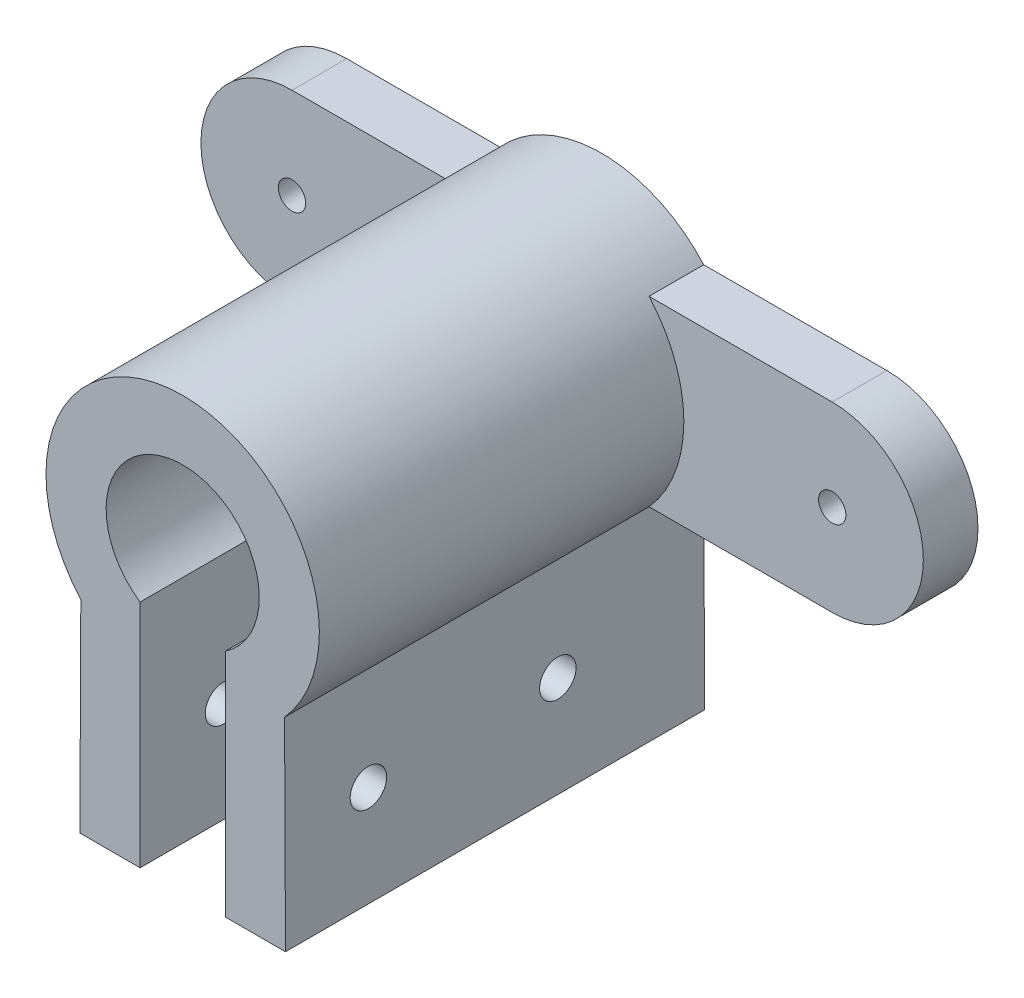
SolidWorks part; units mm, degrees
ref_plane "Front Plane" through (0, 0, 0) normal (0, 0, 1) x (1, 0, 0)
ref_plane "Top Plane" through (0, 0, 0) normal (0, 1, 0) x (1, 0, 0)
ref_plane "Right Plane" through (0, 0, 0) normal (1, 0, 0) x (0, 0, -1)
sketch "Sketch1" plane through (0, 0, 0) normal (0, 0, 1) x (1, 0, 0)
  line L0 (-7.1304, -254.7822) -> (-36.7704, -254.7822) construction
  line L1 (-7.1304, -259.7822) -> (-17.1803, -259.7822)
  line L2 (-7.1304, -249.7822) -> (-17.1803, -249.7822)
  line L3 (-28.3606, -259.7822) -> (-36.7704, -259.7822)
  line L4 (-28.3606, -249.7822) -> (-36.7704, -249.7822)
  circle A0 centre (-7.1304, -254.7822) radius 0.75
  circle A1 centre (-36.7704, -254.7822) radius 0.75
  arc A2 (-7.1304, -259.7822) -> (-7.1304, -249.7822) centre (-7.1304, -254.7822) ccw
  arc A3 (-36.7704, -249.7822) -> (-36.7704, -259.7822) centre (-36.7704, -254.7822) ccw
  circle A4 centre (-22.7704, -254.7822) radius 4 construction
  arc A5 (-28.3606, -259.7822) -> (-17.1803, -259.7822) centre (-22.7704, -254.7822) ccw
  arc A6 (-17.1803, -249.7822) -> (-28.3606, -249.7822) centre (-22.7704, -254.7822) ccw
  point P4 (-21.9504, -254.7822)
  dimension "D1" = 10
  dimension "D2" = 29.64
extrude "Boss-Extrude1" add sketch "Sketch1" along normal blind 3
sketch "Sketch2" plane through (0, 0, 3) normal (0, 0, 1) x (1, 0, 0)
  line L0 (-25.1066, -261.909) -> (-25.1066, -258.2725)
  line L1 (-22.7704, -254.7822) -> (-22.7704, -262.2822) construction
  line L2 (-20.4342, -261.909) -> (-20.4342, -258.2725)
  line L3 (-25.1066, -261.909) -> (-25.1066, -270.9041)
  line L4 (-25.1066, -270.9041) -> (-28.4117, -270.9041)
  line L5 (-28.4117, -270.9041) -> (-28.3606, -259.7822)
  line L6 (-36.7704, -259.7822) -> (-28.3606, -259.7822) construction
  line L7 (-20.4342, -261.909) -> (-20.4342, -270.9041)
  line L8 (-20.4342, -270.9041) -> (-17.1292, -270.9041)
  line L9 (-17.1292, -270.9041) -> (-17.1803, -259.7822)
  arc A0 (-20.4342, -258.2725) -> (-25.1066, -258.2725) centre (-22.7704, -254.7822) ccw
  arc A1 (-17.1803, -259.7822) -> (-28.3606, -259.7822) centre (-22.7704, -254.7822) ccw
extrude "Boss-Extrude3" add sketch "Sketch2" along normal blind 20 and the other way blind 3
sketch "Sketch3" plane through (-27.1667, 0.1248, 0) normal (-1, 0.0046, 0) x (0, 0, 1)
  circle A0 centre (8.0314, -265.4707) radius 1
  circle A1 centre (18.4258, -265.4707) radius 1
extrude "Cut-Extrude1" cut sketch "Sketch3" against normal blind 20
